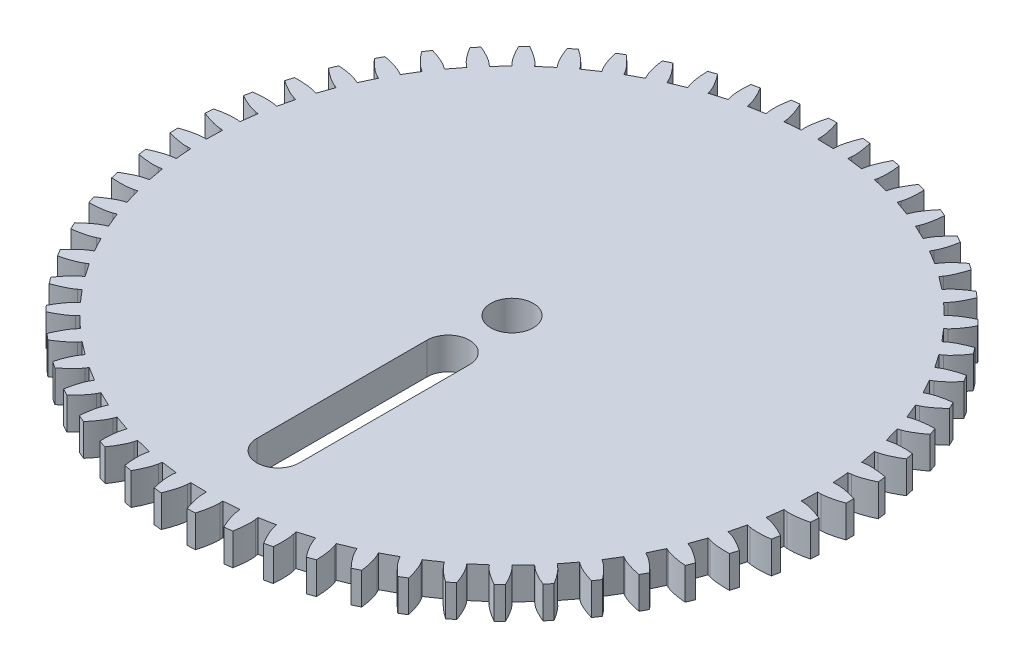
SolidWorks part; units mm, degrees
ref_plane "Front Plane" through (0, 0, 0) normal (0, 0, 1) x (1, 0, 0)
ref_plane "Top Plane" through (0, 0, 0) normal (0, 1, 0) x (1, 0, 0)
ref_plane "Right Plane" through (0, 0, 0) normal (1, 0, 0) x (0, 0, -1)
sketch "Sketch1" plane through (0, 0, 0) normal (0, 1, 0) x (1, 0, 0)
  line L0 (0, 0) -> (0, 14.5222) construction
  line L1 (0, 0) -> (-14.5222, 0) construction
  line L2 (0, 0) -> (-15.4947, -0.4057) construction
  line L3 (0, 0) -> (-14.5023, -0.76) construction
  line L4 (0, 0) -> (-14.4427, -1.518) construction
  circle A0 centre (0, 0) radius 15 construction
  circle A1 centre (0, 0) radius 14.5222 construction
  circle A2 centre (0, 0) radius 14.375 construction
  circle A3 centre (0, 0) radius 15.5 construction
  spline S0 degree 4 poles (-14.5222, 0) (-14.5474, 0) (-14.6179, -0.0026) (-14.7508, -0.0177) (-14.9656, -0.0568) (-15.2352, -0.1274) (-15.5771, -0.2425) (-15.9699, -0.4077) (-16.3888, -0.6197) (-16.8288, -0.8819) (-17.2522, -1.1709) (-17.6587, -1.4833) (-18.0484, -1.8162) (-18.5012, -2.2426) (-19.0162, -2.7882) (-19.5743, -3.4671) (-20.1529, -4.291) (-20.6802, -5.1708) (-21.1469, -6.0836) (-21.5035, -6.9074) (-21.773, -7.6266) (-21.9741, -8.236) (-22.1209, -8.7246) (-22.2874, -9.3478) (-22.4308, -9.9638) (-22.5527, -10.6055) (-22.6716, -11.3455) (-22.7509, -12.0161) (-22.806, -12.5943) (-22.8507, -13.4193) (-22.8604, -13.7954) (-22.8666, -14.374) (-22.8585, -14.6717) (-22.8548, -14.932) (-22.8482, -15.0561) (-22.8445, -15.1782) (-22.8421, -15.2291) knots 0 0 0 0 0 0.005377 0.015084 0.028532 0.04661 0.064855 0.092111 0.119476 0.146842 0.174209 0.201575 0.228941 0.256307 0.307035 0.361767 0.4165 0.471232 0.525964 0.580697 0.608063 0.635429 0.662795 0.690161 0.744894 0.77226 0.799626 0.854358 0.881725 0.909091 0.954545 0.965909 0.977273 0.988636 1 1 1 1 1 construction
  spline S1 degree 4 poles (-14.5222, 0) (-14.5474, 0) (-14.6179, -0.0026) (-14.7508, -0.0177) (-14.9656, -0.0568) (-15.2352, -0.1274) (-15.5771, -0.2425) (-15.9699, -0.4077) (-16.3888, -0.6197) (-16.8288, -0.8819) (-17.2522, -1.1709) (-17.6587, -1.4833) (-18.0484, -1.8162) (-18.5012, -2.2426) (-19.0162, -2.7882) (-19.5743, -3.4671) (-20.1529, -4.291) (-20.6802, -5.1708) (-21.1469, -6.0836) (-21.5035, -6.9074) (-21.773, -7.6266) (-21.9741, -8.236) (-22.1209, -8.7246) (-22.2874, -9.3478) (-22.4308, -9.9638) (-22.5527, -10.6055) (-22.6716, -11.3455) (-22.7509, -12.0161) (-22.806, -12.5943) (-22.8376, -13.1773) (-22.8474, -13.4103) (-22.8512, -13.5267) knots 0 0 0 0 0 0.005377 0.015084 0.028532 0.04661 0.064855 0.092111 0.119476 0.146842 0.174209 0.201575 0.228941 0.256307 0.307035 0.361767 0.4165 0.471232 0.525964 0.580697 0.608063 0.635429 0.662795 0.690161 0.744894 0.77226 0.799626 0.854358 0.881725 0.909091 0.909091 0.909091 0.909091 0.909091
  dimension "D1" = 31
  dimension "D2" = 30
  dimension "D3" = 29.0444
  dimension "D4" = 28.75
  dimension "D5" = 14.5222
  dimension "D6" = 1.5
  dimension "D7" = 3
  dimension "D8" = 6
sketch "Sketch2" plane through (0, 0, 0) normal (0, 1, 0) x (1, 0, 0)
  line L0 (0, 0) -> (-15.4947, -0.4057) construction
  line L1 (0, 0) -> (-15.4947, -0.4057) construction
  line L2 (0, 0) -> (-14.5023, -0.76) construction
  line L3 (0, 0) -> (-14.5222, 0) construction
  line L4 (0, 0) -> (-14.4427, -1.518) construction
  line L5 (0, 0) -> (-14.5023, -0.76) construction
  line L6 (0, 0) -> (-14.5222, 0) construction
  line L7 (0, 0) -> (-14.4427, -1.518) construction
  line L8 (-14.5023, -0.76) -> (-14.3553, -0.7523)
  line L9 (-14.3553, -0.7523) -> (-14.2963, -1.5026)
  line L10 (-14.2963, -1.5026) -> (-14.4427, -1.518) construction
  line L11 (-14.2963, -1.5026) -> (-0.9945, -0.1045)
  line L12 (-14.5222, 0) -> (-1, 0)
  circle A0 centre (0, 0) radius 14.375 construction
  circle A1 centre (0, 0) radius 14.5222 construction
  circle A2 centre (0, 0) radius 15 construction
  circle A3 centre (0, 0) radius 15.5 construction
  circle A4 centre (0, 0) radius 14.375 construction
  circle A5 centre (0, 0) radius 14.5222 construction
  circle A6 centre (0, 0) radius 15 construction
  circle A7 centre (0, 0) radius 15.5 construction
  arc A8 (-15.4887, -0.5918) -> (-15.4984, -0.2196) centre (0, 0) cw
  circle A11 centre (0, 0) radius 1 construction
  arc A12 (-1, 0) -> (-0.9945, -0.1045) centre (0, 0) ccw
  spline S0 degree 4 poles (-74.0802, -1998.8967) (-10.3938, -42.6918) (-11.2181, -0.9111) (-13.1708, 0.2697) (-14.9656, -0.0568) (-15.2352, -0.1274) (-15.5771, -0.2425) (-15.9699, -0.4077) (-16.3888, -0.6197) (-16.8288, -0.8819) (-17.2522, -1.1709) (-17.6587, -1.4833) (-18.0484, -1.8162) (-18.5012, -2.2426) (-19.0162, -2.7882) (-19.5743, -3.4671) (-20.1529, -4.291) (-20.6802, -5.1708) (-21.1469, -6.0836) (-21.5035, -6.9074) (-21.773, -7.6266) (-21.9741, -8.236) (-22.1209, -8.7246) (-22.2874, -9.3478) (-22.4308, -9.9638) (-22.5527, -10.6055) (-22.6716, -11.3455) (-22.7509, -12.0161) (-22.9843, -14.4646) (-22.8882, -19.8604) (-20.3797, 39.2187) (-87.8716, -2012.3551) knots -0.342913 -0.342913 -0.342913 -0.342913 -0.342913 0.005377 0.015084 0.028532 0.04661 0.064855 0.092111 0.119476 0.146842 0.174209 0.201575 0.228941 0.256307 0.307035 0.361767 0.4165 0.471232 0.525964 0.580697 0.608063 0.635429 0.662795 0.690161 0.744894 0.77226 0.799626 0.854358 0.881725 1.351711 1.351711 1.351711 1.351711 1.351711 only from (-14.5222, 0) to (-22.8512, -13.5267) construction
  spline S1 degree 4 poles (-14.5222, 0) (-14.5474, 0) (-14.6179, -0.0026) (-14.7508, -0.0177) (-14.9656, -0.0568) (-15.1845, -0.1141) (-15.3565, -0.1691) (-15.4674, -0.2083) (-15.4984, -0.2196) knots 0 0 0 0 0 0.005377 0.015084 0.028532 0.04661 0.053662 0.053662 0.053662 0.053662 0.053662
  spline S2 degree 4 poles (-14.5023, -0.76) (-14.5275, -0.7614) (-14.5981, -0.7625) (-14.7315, -0.7543) (-14.9481, -0.7266) (-15.1696, -0.6807) (-15.3443, -0.6348) (-15.4571, -0.6015) (-15.4887, -0.5918) knots 0 0 0 0 0 0.005377 0.015084 0.028532 0.04661 0.053662 0.053662 0.053662 0.053662 0.053662
  point P21 (-14.3553, -0.7523)
  point P24 (-14.2963, -1.5026)
  dimension "D2" = 2
extrude "Boss-Extrude1" add sketch "Sketch2" along normal blind 1.5
pattern_circular "CirPattern1" count 60 over 360 of "Boss-Extrude1"
sketch "Sketch3" plane through (0, 1.5, 0) normal (0, 1, 0) x (1, 0, 0)
  line L0 (0, -3) -> (0, -11) construction
  line L1 (1, -3) -> (1, -11)
  line L2 (-1, -3) -> (-1, -11)
  arc A0 (1, -3) -> (-1, -3) centre (0, -3) ccw
  arc A1 (-1, -11) -> (1, -11) centre (0, -11) ccw
  point P3 (0, -7)
  dimension "D2" = 1
  dimension "D1" = 3
  dimension "D3" = 8
extrude "Cut-Extrude1" cut sketch "Sketch3" against normal up to surface (1.5 mm away)
equation "\"Module\"= .5"
equation "\"Number of Teeth\"= 60"
equation "\"Pressure Angle\"= 14.5deg"
equation "\"Pitch Diameter\"= \"Number of Teeth\" * \"Module\""
equation "\"Circular Pitch\"= pi * \"Module\""
equation "\"Addendum\"= \"Module\""
equation "\"Dedendum\"= 1.25 * \"Module\""
equation "\"Base Diameter\"= \"Pitch Diameter\" * cos ( \"Pressure Angle\" )"
equation "\"Base Radius\"= \"Base Diameter\" / 2"
equation "\"Width\"= 1.5"
equation "\"Outside Diameter\"= \"Pitch Diameter\" + 2 * \"Addendum\""
equation "\"D1@Sketch1\"=\"Outside Diameter\""
equation "\"D3@Sketch1\"=\"Base Diameter\""
equation "\"Root Diameter\"= \"Pitch Diameter\" - 2 * \"Dedendum\""
equation "\"D4@Sketch1\"=\"Root Diameter\""
equation "\"Tooth Angle\"= 360 / \"Number of Teeth\""
equation "\"D6@Sketch1\"=\"Tooth Angle\"/4"
equation "\"D7@Sketch1\"=\"Tooth Angle\"/2"
equation "\"D8@Sketch1\"=\"Tooth Angle\""
equation "\"D2@Sketch1\" = \"Pitch Diameter\""
equation "\"Shaft Diameter\"= 2"
equation "\"D1@CirPattern1\" = \"Number of Teeth\""
equation "\"D2@Sketch2\"= \"Shaft Diameter\""
equation "\"D1@Boss-Extrude1\" = \"Width\""
